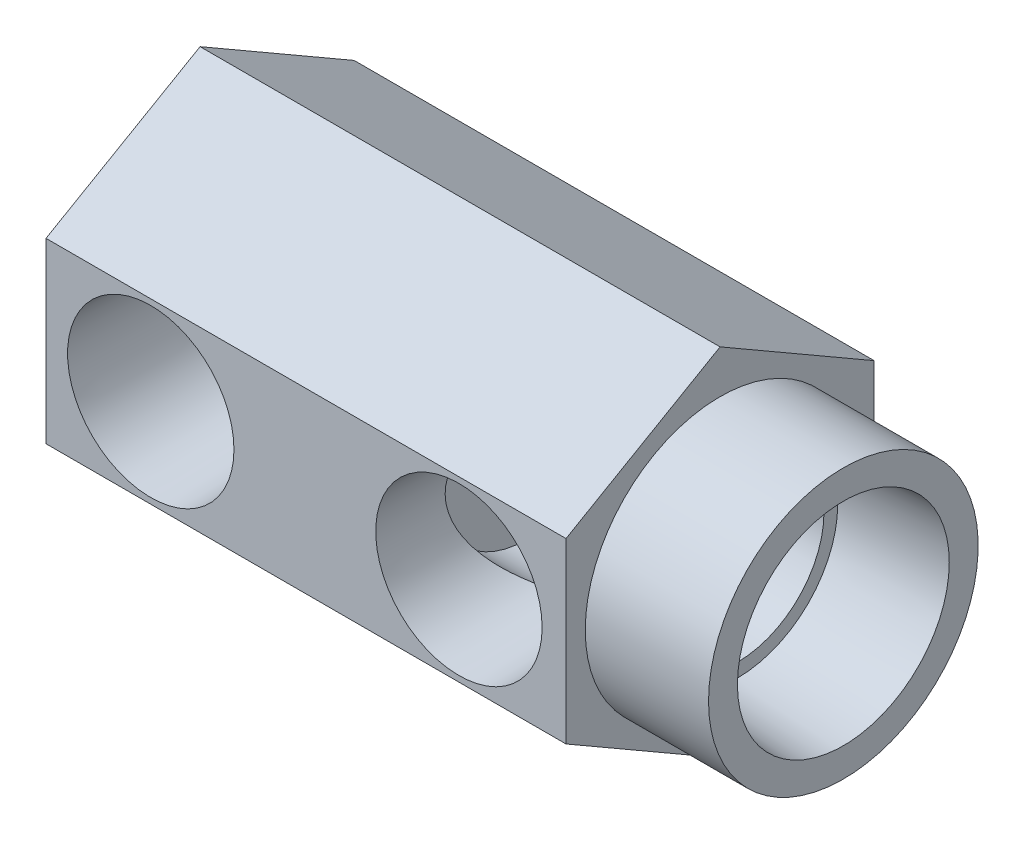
SolidWorks part; units mm, degrees
ref_plane "Front Plane" through (0, 0, 0) normal (0, 0, 1) x (1, 0, 0)
ref_plane "Top Plane" through (0, 0, 0) normal (0, 1, 0) x (1, 0, 0)
ref_plane "Right Plane" through (0, 0, 0) normal (1, 0, 0) x (0, 0, -1)
sketch "Sketch1" plane through (0, 0, 0) normal (1, 0, 0) x (0, 0, -1)
  line L0 (0, 16.1312) -> (0, -16.1312) construction
  line L1 (12.7, 7.3323) -> (0, 14.6647)
  line L2 (0, 14.6647) -> (-12.7, 7.3323)
  line L3 (-12.7, 7.3323) -> (-12.7, -7.3323)
  line L4 (-12.7, -7.3323) -> (0, -14.6647)
  line L5 (0, -14.6647) -> (12.7, -7.3323)
  line L6 (12.7, -7.3323) -> (12.7, 7.3323)
  circle A0 centre (0, 0) radius 12.7 construction
  dimension "D1" = 25.4
extrude "Boss-Extrude1" add sketch "Sketch1" along normal blind 42.8625 separate body
sketch "Sketch2" plane through (0, 0, 0) normal (-1, 0, 0) x (0, 0, 1)
  circle A1 centre (0, 0) radius 11.1125
  dimension "D1" = 22.225
extrude "Boss-Extrude2" add sketch "Sketch2" against normal blind 53.0225
sketch "Sketch3" plane through (0, 0, 0) normal (0, 1, 0) x (1, 0, 0)
  line L2 (44.2849, 7.1437) -> (44.2849, 8.2733)
  line L3 (44.2849, 7.1437) -> (26.8287, 7.1437)
  line L4 (26.8287, 7.1437) -> (26.8287, 0)
  line L5 (53.0225, -11.1125) -> (53.0225, 11.1125) construction
  line L6 (53.0225, 0) -> (53.0225, 8.7313)
  line L7 (44.2849, 8.2733) -> (53.0225, 8.7313)
  line L8 (0, 0) -> (50000, 0) construction
  line L9 (26.8287, 0) -> (53.0225, 0)
  dimension "D1" = 3
  dimension "D2" = 17.4625
  dimension "D3" = 8.7376
  dimension "D4" = 14.2875
  dimension "D5" = 26.1937
revolve "Cut-Revolve1" cut sketch "Sketch3" angle 360 about L8
hole_wizard "1/4 NPT Tapped Hole1" positions "Sketch5" profile "Sketch4" size "1/4" standard "Ansi Inch"
sketch "Sketch5" plane through (0, 0, 12.7) normal (0, 0, 1) x (1, 0, 0)
  line L0 (13.97, 0) -> (-13.97, 0) construction
  line L1 (0, -13.97) -> (0, 13.97) construction
  point P0 (8.636, 0)
  point P1 (34.036, 0)
  dimension "D1" = 8.636
  dimension "D2" = 25.4
sketch "Sketch4" plane through (8.636, 0, 12.7) normal (1, 0, 0) x (0, -1, 0)
  line L0 (0, 0) -> (0, 19.2173)
  line L1 (5.5626, 15.875) -> (0, 19.2173)
  line L2 (-5.5626, 15.875) -> (0, 19.2173) construction
  line L3 (5.5626, 15.875) -> (5.5626, 10.0203)
  line L4 (5.5626, 10.0203) -> (6.558, 10.0203)
  line L5 (6.558, 10.0203) -> (6.858, 0)
  line L6 (-6.558, 10.0203) -> (-6.858, 0) construction
  line L7 (6.858, 0) -> (0, 0)
  line L8 (0, -6.35) -> (0, 107.95) construction
  line L11 (-5.5626, 10.0203) -> (-6.558, 10.0203) construction
  dimension "Tap Drill Dia." = 11.1252
  dimension "Tap Drill Depth" = 15.875
  dimension "Thread Dia." = 13.716
  dimension "Thread Angle" = 3.43
  dimension "Thread Depth" = 10.0203
  dimension "Drill Angle" = 118
hole_wizard "1/4 NPT Tapped Hole2" positions "Sketch7" profile "Sketch6" size "1/4" standard "Ansi Inch"
sketch "Sketch7" plane through (0, 0, -12.7) normal (0, 0, -1) x (-1, 0, 0)
  circle A0 centre (-8.636, 0) radius 6.858 construction
  point P0 (-8.636, 0)
sketch "Sketch6" plane through (8.636, 0, -12.7) normal (1, 0, 0) x (0, 1, 0)
  line L0 (0, 0) -> (0, 20.4111)
  line L1 (5.5626, 17.0688) -> (0, 20.4111)
  line L2 (-5.5626, 17.0688) -> (0, 20.4111) construction
  line L3 (5.5626, 17.0688) -> (5.5626, 10.0203)
  line L4 (5.5626, 10.0203) -> (6.558, 10.0203)
  line L5 (6.558, 10.0203) -> (6.858, 0)
  line L6 (-6.558, 10.0203) -> (-6.858, 0) construction
  line L7 (6.858, 0) -> (0, 0)
  line L8 (0, -6.35) -> (0, 107.95) construction
  line L11 (-5.5626, 10.0203) -> (-6.558, 10.0203) construction
  dimension "Tap Drill Dia." = 11.1252
  dimension "Tap Drill Depth" = 17.0688
  dimension "Thread Dia." = 13.716
  dimension "Thread Angle" = 3.43
  dimension "Thread Depth" = 10.0203
  dimension "Drill Angle" = 118
hole_wizard "I (0.272) Diameter Hole1" positions "Sketch9" profile "Sketch8" hole size "I" standard "Ansi Inch"
sketch "Sketch9" plane through (53.0225, 0, 0) normal (1, 0, 0) x (0, 0, -1)
  circle A0 centre (0, 0) radius 8.7313 construction
  point P0 (0, 0)
sketch "Sketch8" plane through (53.0225, 0, 0) normal (0, 1, 0) x (0, 0, -1)
  line L0 (0, 0) -> (0, 43.3506)
  line L1 (0, 43.3506) -> (3.4544, 41.275)
  line L2 (3.4544, 41.275) -> (3.4544, 0)
  line L5 (3.4544, 0) -> (0, 0)
  line L10 (0, 43.3506) -> (-3.4544, 41.275) construction
  line L11 (0, -6.35) -> (0, 107.95) construction
  dimension "Hole Dia." = 6.9088
  dimension "Hole Depth" = 41.275
  dimension "Drill Angle" = 118
hole_wizard "5/16 (0.3125) Diameter Hole1" positions "Sketch11" profile "Sketch10" hole size "5/16" standard "Ansi Inch"
sketch "Sketch11" plane through (53.0225, 0, 0) normal (1, 0, 0) x (0, 0, -1)
  circle A0 centre (0, 0) radius 8.7313 construction
  point P0 (0, 0)
sketch "Sketch10" plane through (53.0225, 0, 0) normal (0, 1, 0) x (0, 0, -1)
  line L0 (0, 0) -> (0, 38.9607)
  line L1 (0, 38.9607) -> (3.9687, 36.576)
  line L2 (3.9687, 36.576) -> (3.9687, 0)
  line L5 (3.9687, 0) -> (0, 0)
  line L10 (0, 38.9607) -> (-3.9688, 36.576) construction
  line L11 (0, -6.35) -> (0, 107.95) construction
  dimension "Hole Dia." = 7.9375
  dimension "Hole Depth" = 36.576
  dimension "Drill Angle" = 118
